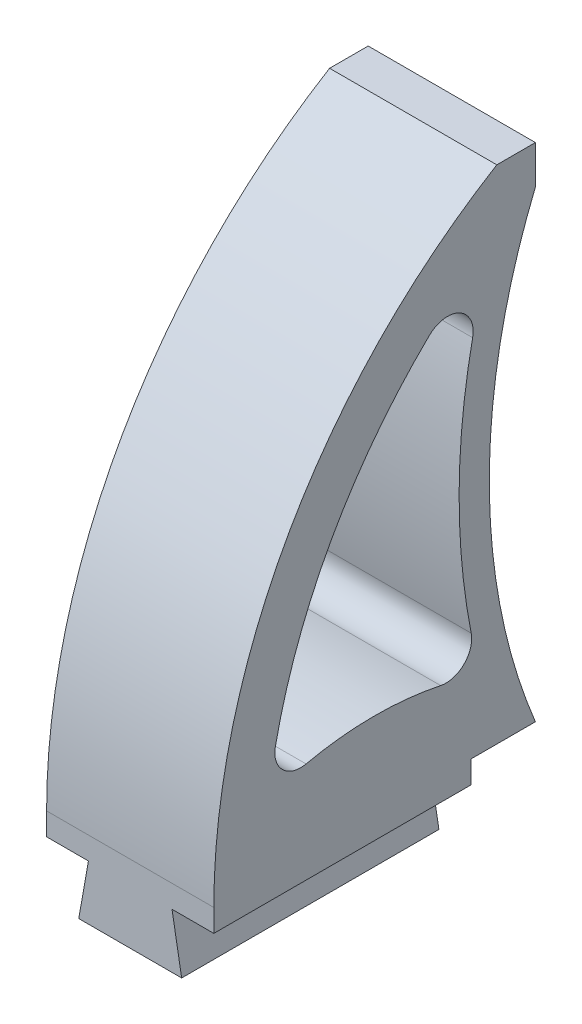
SolidWorks part; units mm, degrees
ref_plane "前视基准面" through (0, 0, 0) normal (0, 0, 1) x (1, 0, 0)
ref_plane "上视基准面" through (0, 0, 0) normal (0, 1, 0) x (1, 0, 0)
ref_plane "右视基准面" through (0, 0, 0) normal (1, 0, 0) x (0, 0, -1)
other "Configuration Table"
sketch "草图1" plane through (0, 0, 0) normal (1, 0, 0) x (0, 0, -1)
  line L0 (-20, -3.2784) -> (-20, 2.7216)
  line L1 (2, 41.7216) -> (5, 41.7216)
  line L2 (5, 41.7216) -> (5, 38.7216)
  line L3 (5, 2.7216) -> (0, 2.7216)
  line L4 (0, 2.7216) -> (0, -3.2784)
  line L5 (0, -3.2784) -> (-20, -3.2784)
  arc A0 (-20, 2.7216) -> (2, 41.7216) centre (25.5682, 2.7216) cw
  arc A1 (5, 38.7216) -> (5, 2.7216) centre (48.4166, 20.7216) ccw
  point P8 (0, 0)
  point P12 (0, 0)
  point P13 (0, 0)
  point P14 (0, 0)
  point P15 (7.6204, 25.8199)
  point P18 (-23.2194, 33.2922)
  dimension "D7" = 47
  dimension "D9" = 39
  dimension "D1" = 6
  dimension "D2" = 6
  dimension "D3" = 20
  dimension "D4" = 5
  dimension "D5" = 3
  dimension "D6" = 3
  dimension "D8" = 25
extrude "凸台-拉伸1" add sketch "草图1" along normal mid plane 13 contours A1 L3 L4 L5 L0 A0 L1 L2
sketch "草图4" plane through (0, 0, 20) normal (0, 0, 1) x (1, 0, 0)
  line L0 (0, -3.2784) -> (0, 10.4135) construction
  line L1 (6.5, -3.2784) -> (-6.5, -3.2784) construction
  line L2 (6.5, 0.9751) -> (3.25, 0.9751)
  line L3 (6.5, -3.2784) -> (6.5, 2.7216) construction
  line L4 (3.25, 0.9751) -> (4, -3.2784)
  line L5 (4, -3.2784) -> (6.5, -3.2784)
  line L6 (6.5, -3.2784) -> (6.5, 0.9751)
  line L7 (-6.5, -3.2784) -> (-6.5, 0.9751)
  line L8 (-4, -3.2784) -> (-6.5, -3.2784)
  line L9 (-3.25, 0.9751) -> (-4, -3.2784)
  line L10 (-6.5, 0.9751) -> (-3.25, 0.9751)
  dimension "D1" = 6.5
  dimension "D2" = 8
  dimension "D3" = 80
extrude "切除-拉伸1" cut sketch "草图4" against normal through all contours L10 L9 M1 M2 | L2 L4 L5 L6
sketch "草图5" plane through (6.5, 0, 0) normal (1, 0, 0) x (0, 0, -1)
  line L0 (5, 2.7216) -> (-20, 2.7216) construction
  line L1 (-7.5, 2.7216) -> (-7.5, 29.8593) construction
  arc A0 (2, 41.7216) -> (-20, 2.7216) centre (25.5682, 2.7216) ccw construction
  arc A1 (-12.8303, 8.8007) -> (-2.3648, 8.8425) centre (-7.5, -15.6244) cw
  arc A2 (-15.2149, 11.1616) -> (-3.2237, 32.8732) centre (25.9069, 2.6175) cw
  arc A3 (0.1214, 31.0245) -> (0.0085, 11.1855) centre (49.0703, 20.8261) ccw
  arc A4 (-2.3648, 8.8425) -> (0.0085, 11.1855) centre (-1.9539, 10.7998) ccw
  arc A5 (-12.8303, 8.8007) -> (-15.2149, 11.1616) centre (-13.2567, 10.7548) cw
  arc A6 (-3.2237, 32.8732) -> (0.1214, 31.0245) centre (-1.8365, 31.4325) cw
  point P15 (0, 0)
  point P16 (-12.2101, 7.0213)
  point P17 (0, 0)
  point P18 (0, 0)
  point P19 (-15.6712, 6.7035)
  point P20 (-10.7621, 19.5944)
  point P21 (-7.6895, 2.3947)
  point P22 (0, 0)
  point P23 (-7.1964, 36.5454)
  point P24 (2.9411, 6.3856)
  point P25 (-5.5248, 34.6669)
  point P26 (-24.7804, 10.4924)
  point P30 (0.75, 7.9751)
  point P33 (-15.75, 7.9751)
  point P36 (1.75, 36.9751)
  dimension "D5" = 42
  dimension "D6" = 25
  dimension "D7" = 50
  dimension "D8" = 2
  dimension "D1" = 16.5
  dimension "D2" = 7
  dimension "D3" = 29
  dimension "D4" = 17.5
extrude "切除-拉伸2" cut sketch "草图5" against normal through all
